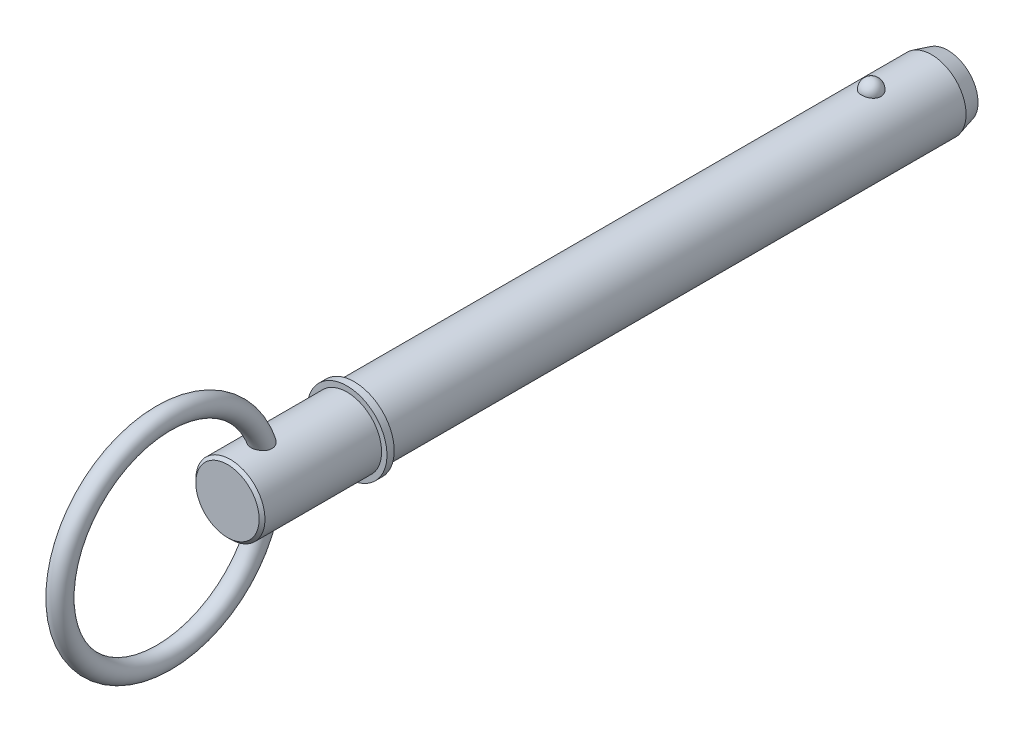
SolidWorks part; units mm, degrees
ref_plane "Front Plane" through (0, 0, 0) normal (0, 0, 1) x (1, 0, 0)
ref_plane "Top Plane" through (0, 0, 0) normal (0, 1, 0) x (1, 0, 0)
ref_plane "Right Plane" through (0, 0, 0) normal (1, 0, 0) x (0, 0, -1)
sketch "Sketch2" plane through (0, 0, 0) normal (0, 0, 1) x (1, 0, 0)
  circle A0 centre (0, 0) radius 9.525
  point P3 (0, 9.525)
  dimension "D1" = 19.05
extrude "Boss-Extrude1" add sketch "Sketch2" along normal blind 139.7
sketch "Sketch3" plane through (0, 0, 0) normal (0, 0, -1) x (-1, 0, 0)
  circle A0 centre (0, 0) radius 9.525
  dimension "D1" = 19.05
extrude "Boss-Extrude2" add sketch "Sketch3" along normal blind 23.8
chamfer "Chamfer1" distance 4.5 angle 15 1 edges at (-9.525, 0, -23.8)
sketch "Sketch18" plane through (0, 0, 0) normal (1, 0, 0) x (0, 0, -1)
  line L0 (19.3, 9.525) -> (-139.7, 9.525) construction
  line L1 (2.69, 12.215) -> (2.69, 6.835)
  line L2 (-139.7, -9.525) -> (19.3, -9.525) construction
  arc A0 (2.69, 12.215) -> (2.69, 6.835) centre (2.69, 9.525) ccw
  point P4 (0, 9.525)
  dimension "D1" = 21.74
revolve "Revolve1" add sketch "Sketch18" angle 360 about L1
sketch "Sketch19" plane through (0, 0, 0) normal (1, 0, 0) x (0, 0, -1)
  line L0 (-33.7288, 0) -> (-46.4542, 0) construction
sketch "Sketch20" plane through (0, 0, 0) normal (1, 0, 0) x (0, 0, -1)
  line L0 (-139.7, 0) -> (-139.7, 11)
  line L1 (-139.7, 9.525) -> (-139.7, -9.525) construction
  line L2 (-139.7, 11) -> (-141.7, 11)
  line L3 (-141.7, 11) -> (-141.7, 0)
  line L4 (-33.7288, 0) -> (-46.4542, 0) construction
  line L5 (-141.7, 0) -> (-139.7, 0)
  dimension "D1" = 11
  dimension "D2" = 2
revolve "Revolve2" add sketch "Sketch20" angle 360 about L0
sketch "Sketch21" plane through (0, 0, 139.7) normal (0, 0, -1) x (-1, 0, 0)
  circle A0 centre (0, 0) radius 9.525
  dimension "D1" = 19.05
extrude "Boss-Extrude3" add sketch "Sketch21" against normal blind 34.93
chamfer "Chamfer2" distance 0.8 angle 45 1 edges at (-9.525, 0, 174.63)
sketch "Sketch23" plane through (0, 0, 0) normal (1, 0, 0) x (0, 0, -1)
  line L0 (-174.63, 8.725) -> (-174.63, -8.725) construction
  circle A0 centre (-192.205, 0) radius 28.575
  point P2 (-163.63, 0)
  dimension "D1" = 57.15
  dimension "D2" = 11
sketch "Sketch24" plane through (0, 0, 0) normal (0, 1, 0) x (1, 0, 0)
  circle A0 centre (0, -163.63) radius 2.75
  dimension "D1" = 5.5
sweep "Sweep1" add profiles "Sketch24" path "Sketch23"
